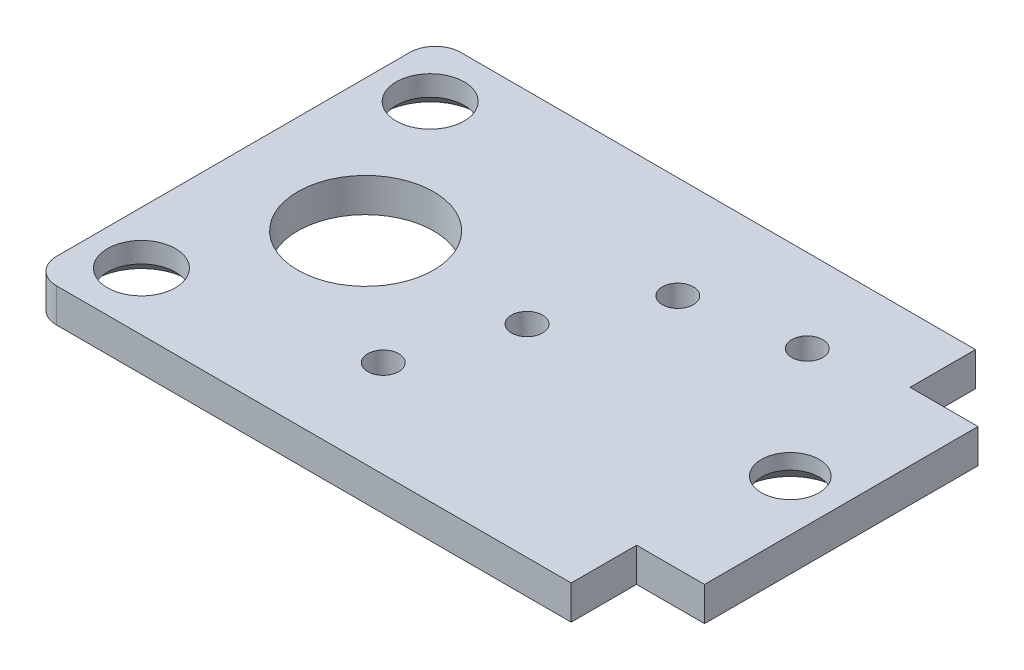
SolidWorks part; units mm, degrees
ref_plane "Front Plane" through (0, 0, 0) normal (0, 0, 1) x (1, 0, 0)
ref_plane "Top Plane" through (0, 0, 0) normal (0, 1, 0) x (1, 0, 0)
ref_plane "Right Plane" through (0, 0, 0) normal (1, 0, 0) x (0, 0, -1)
sketch "Sketch1" plane through (0, 0, 0) normal (0, 1, 0) x (1, 0, 0)
  line L1 (12, 5.95) -> (-3.9, 5.95)
  line L2 (14, 4.025) -> (14, -4.025)
  line L3 (12, -5.95) -> (-3.9, -5.95)
  line L4 (-3.9, 5.95) -> (-3.9, -5.95)
  line L5 (-0.55, 0) -> (0.55, 0) construction
  line L6 (12, 5.95) -> (12, 4.025)
  line L7 (0, -0.55) -> (0, 0.55) construction
  line L8 (12, 4.025) -> (14, 4.025)
  line L9 (12, -5.95) -> (12, -4.025)
  line L10 (12, -4.025) -> (14, -4.025)
  circle A0 centre (0, 0) radius 2
  point P0 (14, 0)
  point P2 (-3.9, 0)
  dimension "D4" = 4
  dimension "D6" = 2
  dimension "D1" = 14
  dimension "D2" = 17.9
  dimension "D3" = 11.9
  dimension "D5" = 8.05
extrude "Boss-Extrude1" add sketch "Sketch1" along normal blind 1
sketch "Sketch2" plane through (0, 1, 0) normal (0, 1, 0) x (1, 0, 0)
  line L0 (-2.35, 4.25) -> (-2.35, -4.25) construction
  line L1 (-0.55, 0) -> (0.55, 0) construction
  line L3 (14, -4.025) -> (14, 4.025) construction
  circle A0 centre (-2.35, 4.25) radius 1
  circle A1 centre (-2.35, -4.25) radius 1
  point P2 (-2.35, 0)
  dimension "D3" = 2
  dimension "D1" = 8.5
  dimension "D2" = 16.35
extrude "Cut-Extrude1" cut sketch "Sketch2" against normal through all
fillet "Fillet1" radius 0.75 2 edges at (-3.9, 0.5, -5.95) (-3.9, 0.5, 5.95)
chamfer "Chamfer1" distance 0.4 angle 45 2 edges at (-2.35, 0, 5.25) (-2.35, 0, -3.25)
sketch "Sketch3" plane through (0, 1, 0) normal (0, 1, 0) x (1, 0, 0)
  line L0 (-0.55, 0) -> (0.55, 0) construction
  line L1 (14, -4.025) -> (14, 4.025) construction
  circle A0 centre (3.6186, -3.1) radius 0.4572
  circle A1 centre (4.75, 0) radius 0.4572
  circle A2 centre (6.2478, 2.9405) radius 0.4572
  circle A3 centre (9.5, 3.5) radius 0.4572
  arc A5 (6.856, 1.5254) -> (6.3481, 4.4776) centre (9.5, 3.5) cw construction
  arc A6 (3.5785, 1.0001) -> (6.2478, -0.3595) centre (6.2478, 2.9405) ccw construction
  arc A7 (5.1489, -3.2758) -> (2.3349, -2.2488) centre (4.75, 0) cw construction
  point P19 (4.75, 0)
  point P22 (3.6186, -3.1)
  point P23 (6.2478, 2.9405)
  dimension "D1" = 0.9144
  dimension "D4" = 3.3
  dimension "D9" = 3.3
  dimension "D10" = 3.3
  dimension "D2" = 3.1
  dimension "D3" = 4.75
  dimension "D5" = 4.5
  dimension "D6" = 7.7522
  dimension "D7" = 10.3814
  dimension "D8" = 3.5
extrude "Cut-Extrude2" cut sketch "Sketch3" against normal through all
hole_wizard "CSK for M1.6 Countersunk Raised Head Screw2" positions "Sketch4" profile "Sketch5" countersink size "M1.6" standard "DIN"
sketch "Sketch4" plane through (0, 0, 0) normal (0, 1, 0) x (1, 0, 0)
  line L0 (-0.55, 0) -> (0.55, 0) construction
  line L1 (14, -4.025) -> (14, 4.025) construction
  point P0 (12.5, 0)
  dimension "D1" = 1.5
sketch "Sketch5" plane through (12.5, 0, 0) normal (1, 0, 0) x (0, 0, -1)
  line L0 (0, 0) -> (0, 1)
  line L1 (0, 1) -> (0.85, 1)
  line L2 (0.85, 1) -> (0.85, 0.55)
  line L3 (0.85, 0.55) -> (1.4, 0)
  line L5 (1.4, 0) -> (0, 0)
  line L6 (-0.85, 0.55) -> (-1.4, 0) construction
  line L11 (0, -6.35) -> (0, 107.95) construction
  dimension "Thru Hole Dia." = 1.7
  dimension "Thru Hole Depth" = 1
  dimension "Near C'Sink Dia." = 2.8
  dimension "Near C'Sink Angle" = 90
